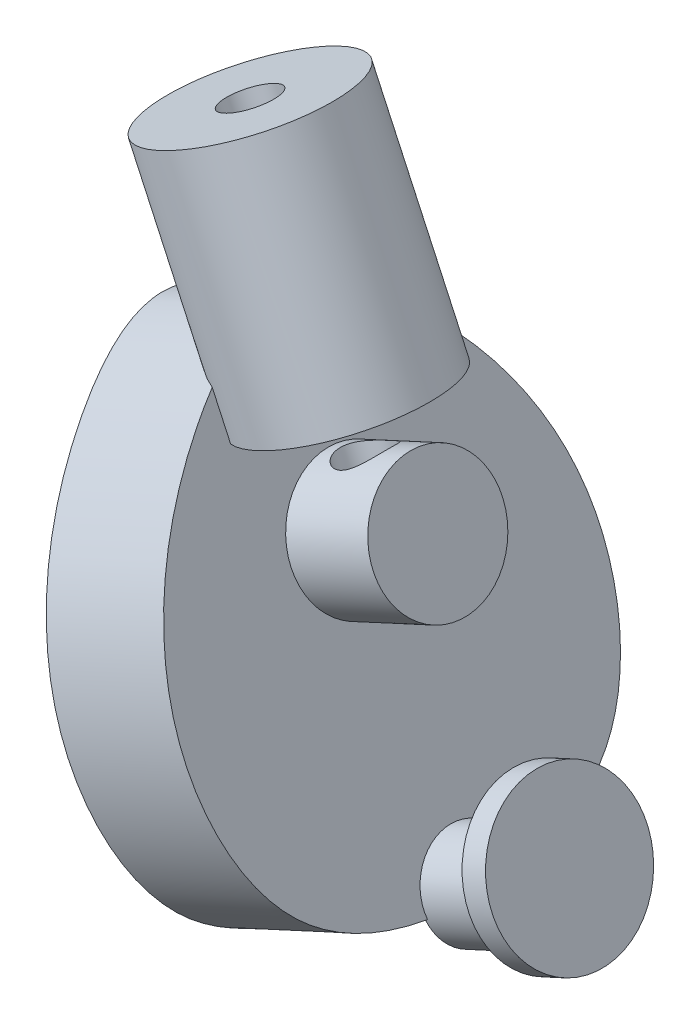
SolidWorks part; units mm, degrees
ref_plane "Alzado" through (0, 0, 0) normal (0, 0, 1) x (1, 0, 0)
ref_plane "Planta" through (0, 0, 0) normal (0, 1, 0) x (1, 0, 0)
ref_plane "Vista lateral" through (0, 0, 0) normal (1, 0, 0) x (0, 0, -1)
sketch3d "Sk_puntos_Plano_placa"
  point P0 (433.1318, 388.4762, 0)
  point P1 (449.8942, 352.1579, 0)
  point P2 (433.1318, 388.4762, 40)
ref_plane "Plano_placa" through (504.8801, 233.0216, 0) normal (-0.908, -0.4191, 0) x (0, 0, 1)
sketch "Sk_Placa" plane through (504.8801, 233.0216, 0) normal (-0.908, -0.4191, 0) x (0, 0, 1)
  spline S0 degree 3 poles (-5.9029, 222.2845) (0, 226.1278) (5.9029, 222.2845) (9.0721, 215.8434) (6.4788, 208.2172) (0, 206.671) (-6.4788, 208.2172) (-9.0721, 215.8434) (-5.9029, 222.2845) (0, 226.1278) (5.9029, 222.2845) knots -0.378517 -0.275079 -0.085901 0 0.085901 0.275079 0.378517 0.5 0.621483 0.724921 0.914099 1 1.085901 1.275079 1.378517 only from (0, 225.2132) to (0, 225.2132)
extrude "Placa" add sketch "Sk_Placa" along normal mid plane 5
sketch3d "Sk_Buje_cable"
  line L0 (411.6202, 444.63, 0) -> (415.3917, 436.4584, 0)
  dimension "D1" = 9
sweep "Buje_cable" add path "Sk_Buje_cable" parameters "D3"=7
sketch3d "Sk_Tornillo_pisacables"
  line L0 (409.8043, 429.4741, 0) -> (418.8839, 433.6647, 0)
  dimension "D1" = 10
sweep "Tornillo_pisacables" add path "Sk_Tornillo_pisacables" parameters "D3"=5
sketch3d "Sk_Paso_cable_principal"
  line L0 (410.7821, 446.4459, 0) -> (418.3251, 430.1027, 0)
  dimension "D1" = 18
sweep "Paso_cable_principal" cut path "Sk_Paso_cable_principal" parameters "D3"=2
sketch3d "Sk_Pestana"
  line L0 (420.0572, 422.5317, 0) -> (423.3259, 424.0403, 0)
  dimension "D1" = 3.6
sweep "Pestana" add path "Sk_Pestana" parameters "D3"=3.6
sketch3d "Sk_Labio"
  line L0 (423.0744, 424.5851, 0) -> (423.9824, 425.0041, 0)
  dimension "D1" = 1
sweep "Labio" add path "Sk_Labio" parameters "D3"=6
sketch3d "Sk_puntos_Plano_yugo"
  point P0 (436.7637, 390.1525, 0)
  point P1 (453.526, 353.8341, 0)
  point P2 (436.7637, 390.1525, 40)
ref_plane "Plano_yugo" through (508.512, 234.6978, 0) normal (-0.908, -0.4191, 0) x (0, 0, 1)
sketch3d "Sk_puntos_Plano_tiro"
  point P0 (420.0013, 426.4708, 0)
  point P1 (456.3197, 443.2332, 0)
  point P2 (420.0013, 426.4708, 40)
ref_plane "Plano_tiro" through (-88.5106, 191.773, 0) normal (0.4191, -0.908, 0) x (-0.908, -0.4191, 0)
